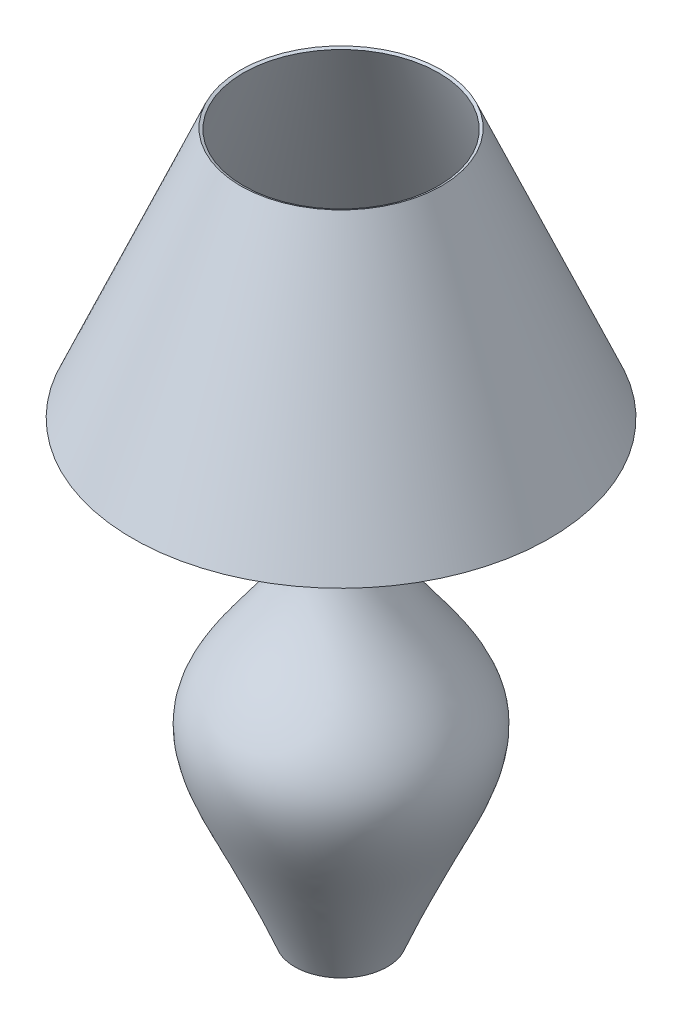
SolidWorks part; units mm, degrees
ref_plane "Płaszczyzna przednia" through (0, 0, 0) normal (0, 0, 1) x (1, 0, 0)
ref_plane "Płaszczyzna górna" through (0, 0, 0) normal (0, 1, 0) x (1, 0, 0)
ref_plane "Płaszczyzna prawa" through (0, 0, 0) normal (1, 0, 0) x (0, 0, -1)
sketch "Szkic1" plane through (0, 0, 0) normal (0, 0, 1) x (1, 0, 0)
  line L0 (341.3608, 682.7216) -> (1706.804, 682.7216) construction
  line L1 (1139.9163, 190.0397) -> (1093.9163, 190.0397)
  line L2 (1112.4163, 610.0397) -> (1132.4163, 610.0397)
  line L3 (1132.4163, 610.0397) -> (1132.4163, 640.0397)
  line L4 (1132.4163, 640.0397) -> (932.4163, 640.0397)
  line L5 (932.4163, 640.0397) -> (1039.9163, 890.0397)
  line L6 (1139.9163, 190.0397) -> (1139.9163, 963.01) construction
  spline S0 degree 3 poles (1093.9163, 190.0397) (1083.1181, 217.8577) (1051.9585, 287.0866) (1001.9006, 388.8536) (1069.5739, 466.144) (1112.1546, 536.7959) (1111.887, 585.6911) (1112.4163, 610.0397) knots 0 0 0 0 0.239172 0.460967 0.681916 0.844506 1 1 1 1
  dimension "D1" = 117.5
  dimension "D2" = 420
  dimension "D3" = 46
  dimension "D4" = 20
  dimension "D5" = 15
  dimension "D6" = 30
  dimension "D7" = 200
  dimension "D8" = 100
  dimension "D9" = 250
revolve "Obrót-cienka ścianka1" add sketch "Szkic1" angle 360 about L6
